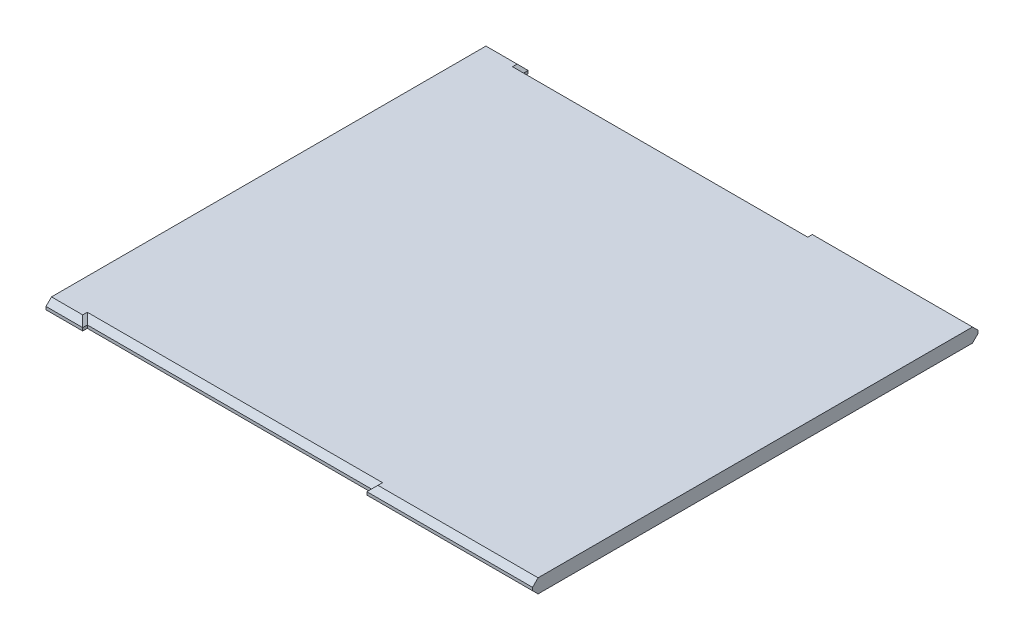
SolidWorks part; units mm, degrees
ref_plane "Front Plane" through (0, 0, 0) normal (1, 0, 0) x (0, 1, 0)
ref_plane "Top Plane" through (0, 0, 0) normal (0, 0, 1) x (0, 1, 0)
ref_plane "Right Plane" through (0, 0, 0) normal (0, 1, 0) x (-1, 0, 0)
sketch "Sketch2"
sketch_block_instance "Block4-1"
sketch_block "Block4" parameters "D1"=6, "D2"=6, "D3"=6, "D4"=3
extrude "Boss-Extrude2" add sketch "Sketch2" along normal mid plane 38.1
chamfer "Chamfer1" distance 15 angle 45 20 edges at (-612.5735, -19.05, -568.6517) (-562.5735, -19.05, -562.3892) (-175.5735, -19.05, -556.1267) (211.4265, -19.05, -562.3892) (437.0265, -19.05, -568.6517) (-612.5735, 19.05, -568.6517) (-562.5735, 19.05, -562.3892) (-175.5735, 19.05, -556.1267) (437.0265, 19.05, -568.6517) (211.4265, 19.05, -562.3892) (-612.5735, -19.05, 644.5483) (-562.5735, -19.05, 638.2858) (-175.5735, -19.05, 632.0233) (211.4265, -19.05, 638.2858) (437.0265, -19.05, 644.5483) (-612.5735, 19.05, 644.5483) (-562.5735, 19.05, 638.2858) (-175.5735, 19.05, 632.0233) (211.4265, 19.05, 638.2858) (437.0265, 19.05, 644.5483)
